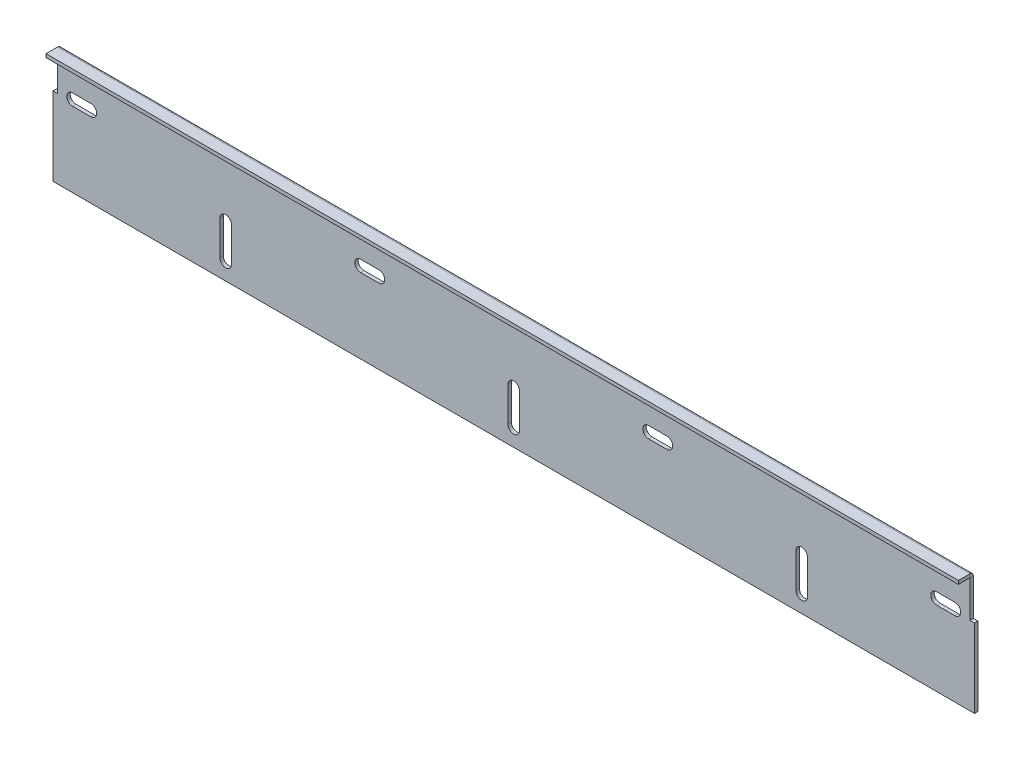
SolidWorks part; units mm, degrees
ref_plane "Front" through (0, 0, 0) normal (0, 0, 1) x (1, 0, 0)
ref_plane "Top" through (0, 0, 0) normal (0, 1, 0) x (1, 0, 0)
ref_plane "Right" through (0, 0, 0) normal (1, 0, 0) x (0, 0, -1)
sketch "Esquisse1" plane through (0, 0, 0) normal (0, 0, 1) x (1, 0, 0)
  line L0 (-274.6052, -21.5) -> (-211.0285, -21.5) construction
  line L1 (-400, 51.5) -> (400, 51.5)
  line L2 (-400, 51.5) -> (-400, -51.5)
  line L3 (-400, -51.5) -> (400, -51.5)
  line L4 (400, 51.5) -> (400, -51.5)
  line L5 (-375, 45.959) -> (-375, 0) construction
  line L6 (-125, 37.9354) -> (-125, 0) construction
  line L7 (11.7288, -21.5) -> (60.5588, -21.5) construction
  line L8 (-383, 13.5) -> (-367, 13.5)
  line L9 (-383, 23.5) -> (-367, 23.5)
  line L10 (-133, 23.5) -> (-117, 23.5)
  line L11 (-117, 13.5) -> (-133, 13.5)
  line L12 (-245, -6.5) -> (-245, -36.5)
  line L13 (-255, -6.5) -> (-255, -36.5)
  line L14 (117, 23.5) -> (133, 23.5)
  line L15 (133, 13.5) -> (117, 13.5)
  line L16 (5, -6.5) -> (5, -36.5)
  line L17 (-5, -6.5) -> (-5, -36.5)
  line L18 (255, -6.5) -> (255, -36.5)
  line L19 (245, -6.5) -> (245, -36.5)
  line L22 (367, 23.5) -> (383, 23.5)
  line L23 (383, 13.5) -> (367, 13.5)
  arc A0 (-383, 23.5) -> (-383, 13.5) centre (-383, 18.5) ccw
  arc A1 (-367, 13.5) -> (-367, 23.5) centre (-367, 18.5) ccw
  arc A2 (-245, -6.5) -> (-255, -6.5) centre (-250, -6.5) ccw
  arc A3 (-255, -36.5) -> (-245, -36.5) centre (-250, -36.5) ccw
  arc A4 (-133, 23.5) -> (-133, 13.5) centre (-133, 18.5) ccw
  arc A5 (-117, 13.5) -> (-117, 23.5) centre (-117, 18.5) ccw
  arc A6 (5, -6.5) -> (-5, -6.5) centre (0, -6.5) ccw
  arc A7 (-5, -36.5) -> (5, -36.5) centre (0, -36.5) ccw
  arc A8 (117, 23.5) -> (117, 13.5) centre (117, 18.5) ccw
  arc A9 (133, 13.5) -> (133, 23.5) centre (133, 18.5) ccw
  arc A10 (255, -6.5) -> (245, -6.5) centre (250, -6.5) ccw
  arc A11 (245, -36.5) -> (255, -36.5) centre (250, -36.5) ccw
  arc A14 (367, 23.5) -> (367, 13.5) centre (367, 18.5) ccw
  arc A15 (383, 13.5) -> (383, 23.5) centre (383, 18.5) ccw
  dimension "D5" = 10
  dimension "D6" = 10
  dimension "D7" = 10
  dimension "D8" = 10
  dimension "D15" = 10
  dimension "D16" = 10
  dimension "D20" = 10
  dimension "D21" = 10
  dimension "D1" = 800
  dimension "D2" = 400
  dimension "D3" = 103
  dimension "D4" = 51.5
  dimension "D9" = 30
  dimension "D10" = 16
  dimension "D11" = 25
  dimension "D12" = 30
  dimension "D13" = 150
  dimension "D14" = 70
  dimension "D17" = 16
  dimension "D18" = 250
  dimension "D19" = 70
  dimension "D22" = 30
  dimension "D23" = 250
extrude "Base-Extrusion" add sketch "Esquisse1" along normal blind 3
sketch "Esquisse2" plane through (0, 0, 3) normal (0, 0, 1) x (1, 0, 0)
  line L0 (400, -51.5) -> (400, 51.5) construction
  line L1 (-400, 51.5) -> (400, 51.5)
  line L2 (-400, 51.5) -> (-400, 48.5)
  line L3 (-400, 48.5) -> (400, 48.5)
  line L4 (400, 51.5) -> (400, 48.5)
  line L5 (-400, -51.5) -> (400, -51.5) construction
  dimension "D1" = 800
  dimension "D2" = 800
  dimension "D3" = 3
  dimension "D4" = 103
extrude "Boss.-Extru.1" add sketch "Esquisse2" along normal blind 10
sheet metal parameters "Tôlerie 1" parameters "D1"=0.001
bend "Pli dans angle1" bend angle 90 parameters "D1"=0, "D5"=1
flatten bends "Dépliage 1" parameters "D1"=0
sketch "Esquisse-Angle1" plane through (0, 0, 3) normal (0, 0, 1) x (1, 0, 0)
  line L0 (400, 48.5045) -> (-400, 48.5045) construction
process bends "Pliage 1" parameters "D1"=0
sketch "Esquisse-Plate1" plane through (0, 0, 3) normal (0, 0, 1) x (1, 0, 0)
sketch "Esquisse3" plane through (0, 0, 13) normal (0, 0, 1) x (1, 0, 0)
  line L0 (400, -51.5) -> (400, 48.499) construction
  line L1 (410.0277, 64.2548) -> (396, 64.2548)
  line L2 (410.0277, 64.2548) -> (410.0277, 16.5)
  line L3 (410.0277, 16.5) -> (396, 16.5)
  line L4 (396, 64.2548) -> (396, 16.5)
  line L5 (400, 51.5) -> (-400, 51.5) construction
  dimension "D1" = 4
  dimension "D2" = 35
extrude "Enlèv. mat.-Extru.2" cut sketch "Esquisse3" against normal through all
mirror "Symétrie1" about plane through (0, 0, 0) normal (1, 0, 0) of "Enlèv. mat.-Extru.2"
